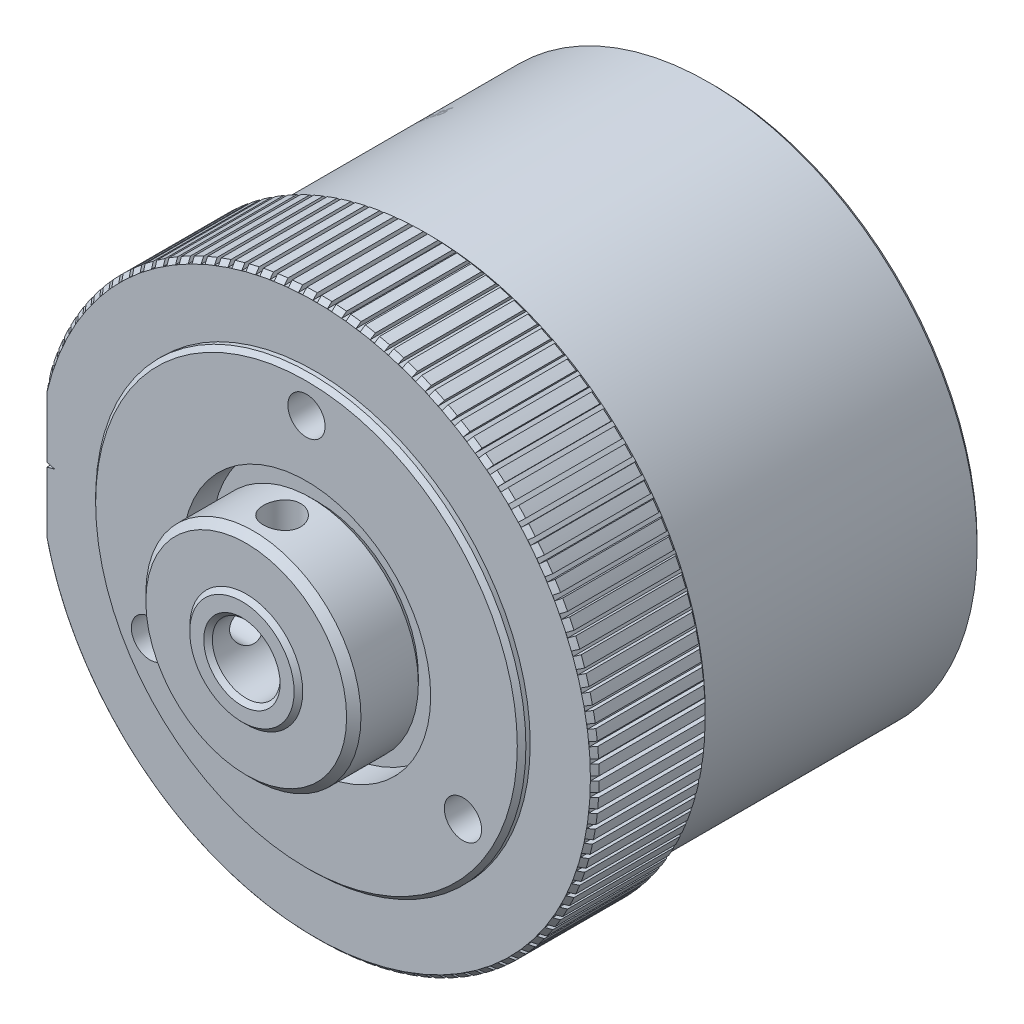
SolidWorks part; units mm, degrees
ref_plane "Front Plane" through (0, 0, 0) normal (0, 0, 1) x (1, 0, 0)
ref_plane "Top Plane" through (0, 0, 0) normal (0, 1, 0) x (1, 0, 0)
ref_plane "Right Plane" through (0, 0, 0) normal (1, 0, 0) x (0, 0, -1)
sketch "Sketch3" plane through (0, 0, 0) normal (1, 0, 0) x (0, 0, -1)
  line L0 (-15.4719, 0) -> (45.426, 0) construction
  line L1 (0, 55) -> (0, -55) construction
  line L2 (1.016, 9.525) -> (6.096, 9.525)
  line L3 (6.731, 8.89) -> (6.731, 5.0038)
  line L4 (8.367, 5.0038) -> (8.367, 11)
  line L5 (8.367, 11) -> (5.715, 11)
  line L6 (6.731, 5.0038) -> (8.367, 5.0038)
  line L7 (0.381, 5.0038) -> (0, 4.6228)
  line L8 (5.715, 11) -> (5.715, 18.669)
  line L9 (6.096, 19.05) -> (6.477, 19.05)
  line L10 (0.381, 8.89) -> (1.016, 9.525)
  line L11 (6.477, 19.05) -> (6.477, 24.382)
  line L12 (6.858, 24.763) -> (16.256, 24.763)
  line L13 (6.096, 9.525) -> (6.731, 8.89)
  line L14 (5.715, 18.669) -> (6.096, 19.05)
  line L15 (16.637, 24.382) -> (16.637, 23.749)
  line L16 (6.477, 24.382) -> (6.858, 24.763)
  line L17 (16.637, 23.749) -> (41.3512, 23.749)
  line L18 (41.7322, 23.368) -> (41.7322, 11)
  line L19 (16.256, 24.763) -> (16.637, 24.382)
  line L20 (41.3512, 23.749) -> (41.7322, 23.368)
  line L21 (41.7322, 11) -> (39.7764, 11)
  line L22 (39.7764, 11) -> (39.7764, 5.0038)
  line L23 (39.3979, 3) -> (0.381, 3)
  line L25 (0, 3.381) -> (0, 4.6228)
  line L26 (39.7764, 5.0038) -> (39.7789, 5.0038)
  line L27 (39.7789, 5.0038) -> (39.7789, 3.381)
  line L28 (0.381, 5.0038) -> (0.381, 8.89)
  line L29 (0.381, 3) -> (0, 3.381)
  line L30 (39.7789, 3.381) -> (39.3979, 3)
  point P1 (0.381, 9.525)
  point P5 (5.715, 19.05)
  point P7 (6.731, 9.525)
  point P19 (6.477, 24.763)
  point P23 (16.637, 24.763)
  point P29 (41.7322, 23.749)
  point P34 (39.7789, 3)
  point P37 (0, 3)
  dimension "D1" = 6
  dimension "D2" = 0.381
  dimension "D3" = 19.05
  dimension "D4" = 22
  dimension "D5" = 38.1
  dimension "D6" = 49.526
  dimension "D7" = 47.498
  dimension "D8" = 22
  dimension "D9" = 1.9558
  dimension "D10" = 10.0076
  dimension "D11" = 5.334
  dimension "D12" = 2.652
  dimension "D13" = 0.762
  dimension "D14" = 10.16
  dimension "D15" = 25.0952
  dimension "D16" = 6.35
  dimension "D17" = 10.0076
  dimension "D18" = 0.381
  dimension "D19" = 10.0076
  dimension "D20" = 0.0025
revolve "Revolve1" add sketch "Sketch3" angle 360 about L0
sketch "Sketch5" plane through (0, 0, -6.477) normal (0, 0, 1) x (1, 0, 0)
  line L0 (0, 42.4176) -> (0, -24.5745) construction
  line L2 (-0.1905, -24.765) -> (0.1905, -24.765)
  line L3 (-0.1905, -24.765) -> (-0.1905, -24.384)
  line L4 (-0.1905, -24.384) -> (0.1905, -24.384)
  line L5 (0.1905, -24.765) -> (0.1905, -24.384)
  line L6 (-0.1905, -24.765) -> (0.1905, -24.384) construction
  line L7 (-0.1905, -24.384) -> (0.1905, -24.765) construction
  dimension "D1" = 0.381
  dimension "D2" = 0.381
  dimension "D3" = 24.384
extrude "Cut-Extrude2" cut sketch "Sketch5" against normal blind 72.136
pattern_circular "CirPattern1" count 120 over 360 about axis through (0, 0, 0) along (0, 0, 1) of "Cut-Extrude2"
sketch "Sketch6" plane through (0, 0, -5.715) normal (0, 0, 1) x (1, 0, 0)
  line L0 (-26.289, 0) -> (0, 0) construction
  line L1 (-26.289, 12.7) -> (-23.749, 12.7)
  line L2 (-26.289, 12.7) -> (-26.289, -12.7)
  line L3 (-26.289, -12.7) -> (-23.749, -12.7)
  line L4 (-23.749, 12.7) -> (-23.749, 0.1905)
  line L5 (-23.038, 0) -> (-23.749, 0.1905)
  line L6 (-23.038, 0) -> (-23.749, -0.1905)
  line L7 (-23.749, -0.1905) -> (-23.749, -12.7)
  dimension "D1" = 23.749
  dimension "D2" = 2.54
  dimension "D3" = 12.7
  dimension "D4" = 12.7
  dimension "D5" = 30
  dimension "D6" = 0.381
extrude "Cut-Extrude3" cut sketch "Sketch6" against normal up to surface (10.922 mm away)
ref_plane "Plane1" through (0, 9.525, 0) normal (0, 1, 0) x (-1, 0, 0)
hole_wizard "M4x0.7 Tapped Hole1" positions "Sketch8" profile "Sketch7" tap size "M4x0.7" standard "Ansi Metric"
sketch "Sketch8" plane through (0, 9.525, 0) normal (0, 1, 0) x (-1, 0, 0)
  line L1 (0, 0) -> (0, -5.715) construction
  line L2 (4.6228, 0) -> (-4.6228, 0) construction
  line L3 (18.669, -5.715) -> (-18.669, -5.715) construction
  line L5 (8.89, -0.381) -> (-8.89, -0.381) construction
  point P15 (0, -3.556)
  dimension "D1" = 3.175
sketch "Sketch7" plane through (0, 9.525, -3.556) normal (1, 0, 0) x (0, 0, 1)
  line L0 (0, 0) -> (0, 19.05)
  line L1 (0, 19.05) -> (1.65, 19.05)
  line L2 (1.65, 19.05) -> (1.65, 0)
  line L5 (1.65, 0) -> (0, 0)
  line L11 (0, -6.35) -> (0, 107.95) construction
  dimension "Thru Tap Drill Dia." = 3.3
  dimension "Thru Tap Drill Depth" = 19.05
pattern_circular "CirPattern2" count 2 over 90 about axis through (0, 0, -1.016) along (0, 0, 1) of "M4x0.7 Tapped Hole1"
hole_wizard "M4x0.7 Tapped Hole2" positions "Sketch10" profile "Sketch9" tap size "M4x0.7" standard "Ansi Metric"
sketch "Sketch10" plane through (0, 0, -5.715) normal (0, 0, 1) x (1, 0, 0)
  line L0 (0, 0) -> (0, 18.669) construction
  line L3 (0, 0) -> (16.1678, -9.3345) construction
  line L6 (0, 0) -> (-16.1678, -9.3345) construction
  circle A0 centre (0, 0) radius 18.669 construction
  circle A2 centre (0, 0) radius 16.002 construction
  point P0 (0, 16.002)
  point P1 (13.8581, -8.001)
  point P3 (-13.8581, -8.001)
  dimension "D3" = 32.004
  dimension "D1" = 120
  dimension "D2" = 120
sketch "Sketch9" plane through (0, 16.002, -5.715) normal (1, 0, 0) x (0, -1, 0)
  line L0 (0, 0) -> (0, 10.8974)
  line L1 (0, 10.8974) -> (1.65, 9.906)
  line L2 (1.65, 9.906) -> (1.65, 0)
  line L5 (1.65, 0) -> (0, 0)
  line L10 (0, 10.8974) -> (-1.65, 9.906) construction
  line L11 (0, -6.35) -> (0, 107.95) construction
  dimension "Tap Drill Dia." = 3.3
  dimension "Tap Drill Depth" = 9.906
  dimension "Drill Angle" = 118
ref_plane "Plane2" through (0, 0, -23.7236) normal (0, 0, 1) x (1, 0, 0)
mirror "Mirror1" about plane through (0, 0, -23.7236) normal (0, 0, 1) of "M4x0.7 Tapped Hole2"
ref_plane "Plane3" through (-23.749, 0, 0) normal (-1, 0, 0) x (0, 0, 1)
sketch "Sketch11" plane through (-23.749, 0, 0) normal (-1, 0, 0) x (0, 0, 1)
  line L0 (-28.9941, 23.749) -> (-28.9941, -23.749) construction
  line L1 (-16.637, 23.749) -> (-41.3512, 23.749) construction
  line L2 (-41.3512, -23.749) -> (-16.637, -23.749) construction
  text T0 "MAGTORK" font "Calibri" height 2.54
wrap "Wrap1" sketch "Sketch11" wrap type scribe source sketch "Sketch11"
sketch "Sketch12" plane through (-23.749, 0, 0) normal (-1, 0, 0) x (0, 0, 1)
  line L0 (-28.9941, 23.749) -> (-28.9941, -23.749) construction
  line L1 (-16.637, 23.749) -> (-41.3512, 23.749) construction
  line L2 (-41.3512, -23.749) -> (-16.637, -23.749) construction
  line L3 (-31.5341, -23.749) -> (-31.5341, 23.749) construction
  text T0 "Model: MTL1.25   " font "Calibri" height 1.016
  dimension "D1" = 2.54
wrap "Wrap2" sketch "Sketch12" wrap type scribe source sketch "Sketch12"
